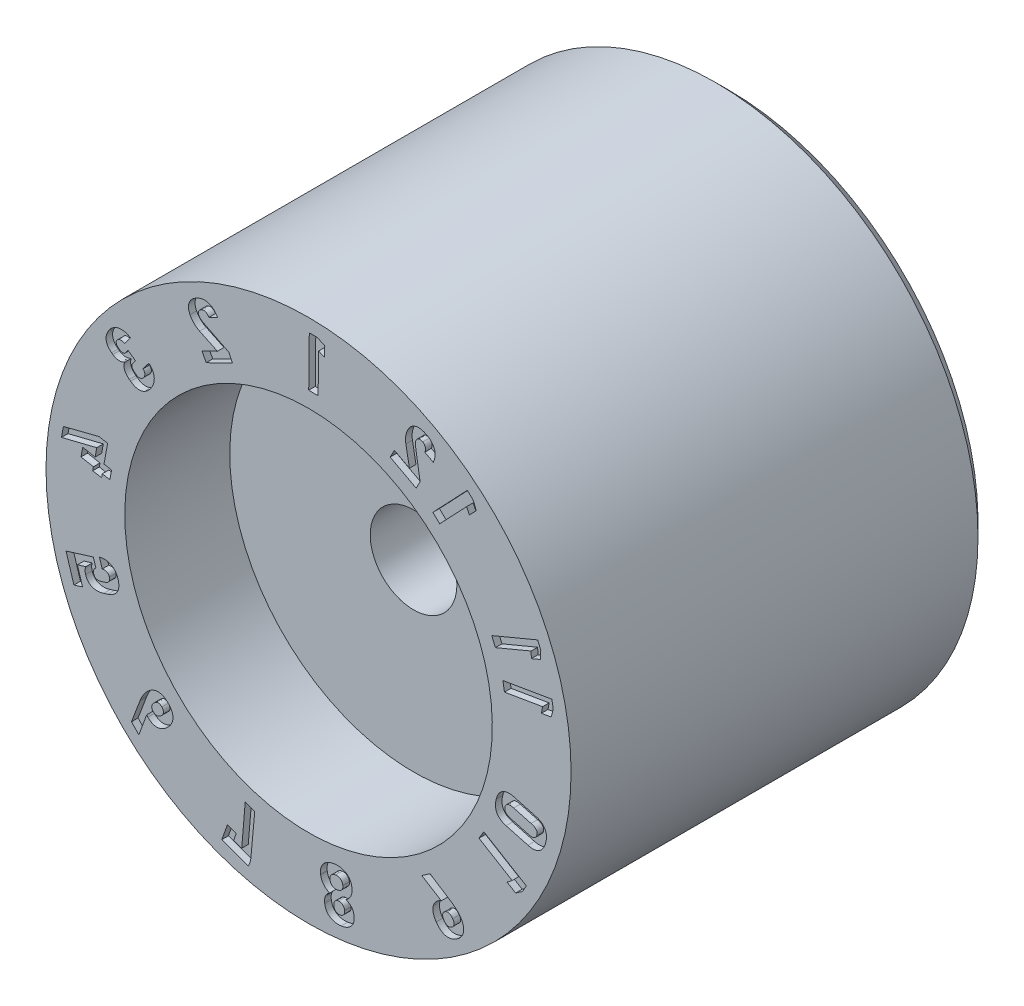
SolidWorks part; units mm, degrees
ref_plane "Front Plane" through (0, 0, 0) normal (0, 0, 1) x (1, 0, 0)
ref_plane "Top Plane" through (0, 0, 0) normal (0, 1, 0) x (1, 0, 0)
ref_plane "Right Plane" through (0, 0, 0) normal (1, 0, 0) x (0, 0, -1)
sketch "Sketch1" plane through (0, 0, 0) normal (-1, 0, 0) x (0, 0, 1)
  line L0 (0, 0) -> (75.4695, 0) construction
  line L2 (-16, -1.65) -> (-16, -9.5)
  line L4 (-15.5, -10) -> (0, -10)
  line L5 (0, -10) -> (0, -7)
  line L7 (0, -7) -> (-4, -7)
  line L8 (-4, -7) -> (-4, -1.65)
  line L9 (-4, -1.65) -> (-16, -1.65)
  line L12 (-16, -9.5) -> (-15.5, -10)
  point P6 (-16, -10)
  dimension "D1" = 16
  dimension "D2" = 20
  dimension "D3" = 14
  dimension "D4" = 4
  dimension "D5" = 3.3
revolve "Revolve1" add sketch "Sketch1" angle 360 about L0
sketch "Sketch2" plane through (0, 0, 0) normal (0, 0, 1) x (0, -1, 0)
  line L0 (-7.5996, 0.0069) -> (-7.5958, 0.3657)
  line L1 (-7.5958, 0.3657) -> (-9.0794, 0.3823)
  line L2 (-9.0794, 0.3823) -> (-8.9886, 0.6135)
  line L3 (-8.9886, 0.6135) -> (-9.3703, 0.6178)
  line L4 (-9.3703, 0.6178) -> (-9.5016, 0.3347)
  line L5 (-9.5016, 0.3347) -> (-9.5049, 0.0284)
  line L6 (-9.5049, 0.0284) -> (-7.5996, 0.0069)
  line L7 (-7.3322, -3.037) -> (-7.8145, -3.9955)
  line L8 (-7.9807, -4.1796) -> (-7.9833, -4.1806)
  line L9 (-8.1027, -3.794) -> (-8.1017, -3.7933)
  line L10 (-8.1017, -3.7933) -> (-8.2622, -3.4647)
  line L11 (-8.2622, -3.4647) -> (-8.2632, -3.4655)
  line L12 (-7.8315, -4.5152) -> (-7.8305, -4.5145)
  line L13 (-7.4689, -4.1482) -> (-7.1449, -3.4711)
  line L14 (-7.1449, -3.4711) -> (-6.8609, -4.0528)
  line L15 (-6.8609, -4.0528) -> (-6.5519, -3.9019)
  line L16 (-6.5519, -3.9019) -> (-7.0432, -2.896)
  line L17 (-7.0432, -2.896) -> (-7.3322, -3.037)
  line L18 (-5.4454, -6.0827) -> (-5.1483, -6.3049)
  line L19 (-4.8363, -6.5796) -> (-4.8629, -6.6151)
  line L20 (-5.1385, -6.6924) -> (-5.2676, -6.5959)
  line L21 (-5.2676, -6.5959) -> (-5.475, -6.8728)
  line L22 (-5.475, -6.8728) -> (-5.3459, -6.9693)
  line L23 (-5.3491, -7.2127) -> (-5.3685, -7.2387)
  line L24 (-5.6349, -7.0057) -> (-5.9309, -6.7844)
  line L25 (-5.0822, -7.4988) -> (-5.0477, -7.4526)
  line L26 (-4.5383, -6.8241) -> (-4.5037, -6.7779)
  line L27 (-2.077, -7.9758) -> (-1.7317, -9.3373)
  line L28 (-1.7317, -9.3373) -> (-1.3338, -9.41)
  line L29 (-1.3338, -9.41) -> (-1.6662, -8.0669)
  line L30 (-1.6662, -8.0669) -> (-1.3258, -8.1293)
  line L31 (-0.8279, -8.2207) -> (-0.7656, -7.882)
  line L32 (-0.7656, -7.882) -> (-0.9119, -7.8552)
  line L33 (-2.0176, -7.6524) -> (-2.077, -7.9758)
  line L34 (-1.4125, -8.602) -> (-1.0607, -8.6665)
  line L35 (-1.0607, -8.6665) -> (-0.974, -8.1939)
  line L36 (-0.859, -7.5674) -> (-1.2109, -7.5029)
  line L37 (-1.2109, -7.5029) -> (-1.2636, -7.7907)
  line L38 (1.8893, -7.964) -> (1.8897, -7.9651)
  line L39 (1.8897, -7.9651) -> (2.2305, -7.8595)
  line L40 (2.2305, -7.8595) -> (2.2301, -7.8583)
  line L41 (2.6162, -7.7531) -> (2.6631, -7.905)
  line L42 (2.3237, -8.0992) -> (2.0053, -8.1979)
  line L43 (2.0053, -8.1979) -> (2.3275, -9.2374)
  line L44 (2.3275, -9.2374) -> (3.299, -8.9366)
  line L45 (3.299, -8.9366) -> (3.1972, -8.6084)
  line L46 (3.1972, -8.6084) -> (2.5665, -8.8036)
  line L47 (2.5665, -8.8036) -> (2.4677, -8.4838)
  line L48 (3.0042, -7.7996) -> (2.9573, -7.6478)
  line L49 (5.4075, -6.137) -> (5.4083, -6.1378)
  line L50 (5.8684, -6.4244) -> (6.7136, -6.744)
  line L51 (6.7136, -6.744) -> (7.0043, -6.4628)
  line L52 (7.0043, -6.4628) -> (6.1949, -6.1653)
  line L54 (6.2113, -5.3707) -> (6.2101, -5.3696)
  line L55 (5.9375, -5.6024) -> (5.9386, -5.6035)
  line L56 (5.6533, -5.8773) -> (5.6525, -5.8765)
  line L57 (9.0204, -2.2051) -> (7.319, -2.0476)
  line L58 (7.319, -2.0476) -> (7.1891, -2.4116)
  line L59 (7.1891, -2.4116) -> (8.7854, -2.5452)
  line L60 (8.7854, -2.5452) -> (8.6761, -2.8512)
  line L61 (8.6761, -2.8512) -> (8.4078, -2.7552)
  line L62 (8.4078, -2.7552) -> (8.288, -3.0911)
  line L63 (8.288, -3.0911) -> (8.8799, -3.3027)
  line L64 (8.8799, -3.3027) -> (9.2435, -2.2847)
  line L65 (9.2435, -2.2847) -> (9.0204, -2.2051)
  line L66 (8.137, 0.4604) -> (8.1679, 0.4643)
  line L67 (8.9852, 0.6117) -> (9.0345, 0.618)
  line L68 (8.8875, 1.7331) -> (8.8382, 1.7268)
  line L69 (8.0105, 1.6566) -> (7.9796, 1.6527)
  line L70 (8.0781, 1.3048) -> (8.096, 1.3074)
  line L71 (8.1585, 0.8236) -> (8.1389, 0.8213)
  line L72 (8.8704, 1.37) -> (8.8887, 1.3727)
  line L73 (8.9408, 0.9662) -> (8.9215, 0.964)
  line L75 (7.5117, 4.861) -> (7.5131, 4.8617)
  line L76 (6.8736, 5.7786) -> (6.8721, 5.7778)
  line L77 (6.5208, 5.373) -> (6.0411, 4.6271)
  line L78 (6.0411, 4.6271) -> (6.2572, 4.3137)
  line L79 (6.2572, 4.3137) -> (6.718, 5.0575)
  line L80 (7.0906, 5.4908) -> (7.0917, 5.4917)
  line L81 (7.3164, 5.1633) -> (7.3153, 5.1624)
  line L82 (3.6319, 6.676) -> (3.9381, 6.4919)
  line L83 (3.9381, 6.4919) -> (4.6987, 7.7561)
  line L84 (4.6987, 7.7561) -> (4.8512, 7.5621)
  line L85 (4.8512, 7.5621) -> (5.0466, 7.8873)
  line L86 (5.0466, 7.8873) -> (4.8703, 8.1423)
  line L87 (4.8703, 8.1423) -> (4.6089, 8.2996)
  line L88 (4.6089, 8.2996) -> (3.6319, 6.676)
  line L89 (3.0089, 7.5227) -> (3.2351, 8.3599)
  line L90 (2.1334, 8.6578) -> (1.9071, 7.8206)
  line L91 (2.2782, 7.8156) -> (2.4566, 8.4754)
  line L92 (2.8644, 8.3648) -> (2.6859, 7.705)
  line L93 (-1.7202, 7.4035) -> (-1.3681, 7.4633)
  line L94 (-1.3681, 7.4633) -> (-1.6145, 8.9162)
  line L95 (-1.6145, 8.9162) -> (-1.3731, 8.8689)
  line L96 (-1.3731, 8.8689) -> (-1.4365, 9.242)
  line L97 (-1.4365, 9.242) -> (-1.7365, 9.321)
  line L98 (-1.7365, 9.321) -> (-2.0368, 9.2698)
  line L99 (-2.0368, 9.2698) -> (-1.7202, 7.4035)
  line L100 (-2.992, 6.9804) -> (-2.6631, 7.1181)
  line L101 (-2.6631, 7.1181) -> (-3.2316, 8.4786)
  line L102 (-3.2316, 8.4786) -> (-2.985, 8.4869)
  line L103 (-2.985, 8.4869) -> (-3.1313, 8.8364)
  line L104 (-3.1313, 8.8364) -> (-3.4415, 8.8452)
  line L105 (-3.4415, 8.8452) -> (-3.7225, 8.7276)
  line L106 (-3.7225, 8.7276) -> (-2.992, 6.9804)
  line L107 (-5.9343, 4.7347) -> (-5.6866, 4.9957)
  line L108 (-5.6866, 4.9957) -> (-6.7643, 6.019)
  line L109 (-6.7643, 6.019) -> (-6.5406, 6.1274)
  line L110 (-6.5406, 6.1274) -> (-6.8178, 6.3903)
  line L111 (-6.8178, 6.3903) -> (-7.1072, 6.2719)
  line L112 (-7.1072, 6.2719) -> (-7.3188, 6.0491)
  line L113 (-7.3188, 6.0491) -> (-5.9343, 4.7347)
  line L114 (-6.7002, 4.2495) -> (-7.761, 4.0777)
  line L115 (-8.0082, 4.1043) -> (-8.0104, 4.1056)
  line L116 (-7.7669, 4.4297) -> (-7.7659, 4.4289)
  line L117 (-7.7659, 4.4289) -> (-7.5934, 4.752)
  line L118 (-7.5934, 4.752) -> (-7.5944, 4.7528)
  line L119 (-8.1926, 3.7861) -> (-8.1913, 3.7856)
  line L120 (-7.6818, 3.7074) -> (-6.9424, 3.8423)
  line L121 (-6.9424, 3.8423) -> (-7.2472, 3.2704)
  line L122 (-7.2472, 3.2704) -> (-6.9433, 3.1086)
  line L123 (-6.9433, 3.1086) -> (-6.4159, 4.0981)
  line L124 (-6.4159, 4.0981) -> (-6.7002, 4.2495)
  line L125 (-1.3258, -8.1293) -> (-1.4125, -8.602)
  line L126 (-0.9119, -7.8552) -> (-0.859, -7.5674)
  line L127 (-0.974, -8.1939) -> (-0.8279, -8.2207)
  line L128 (-1.2636, -7.7907) -> (-2.0176, -7.6524)
  circle A0 centre (0, 0) radius 7.6 construction
  spline S0 degree 3 poles (-7.8145, -3.9955) (-7.8344, -4.0363) (-7.8656, -4.0836) (-7.9117, -4.131) (-7.941, -4.1561) (-7.9645, -4.1715) (-7.9807, -4.1796) knots 0 0 0 0 0.540924 0.666719 0.78521 1 1 1 1
  spline S1 degree 3 poles (-7.9833, -4.1806) (-8.004, -4.191) (-8.037, -4.2009) (-8.0815, -4.1989) (-8.1123, -4.1891) (-8.1409, -4.1718) (-8.1785, -4.1384) (-8.1981, -4.1037) (-8.2106, -4.0797) knots 0 0 0 0 0.246374 0.357484 0.468975 0.586096 0.710177 1 1 1 1
  spline S2 degree 3 poles (-8.2106, -4.0797) (-8.2224, -4.0555) (-8.2345, -4.0166) (-8.2327, -3.9633) (-8.222, -3.9253) (-8.2041, -3.8885) (-8.1673, -3.8404) (-8.1299, -3.8115) (-8.1027, -3.794) knots 0 0 0 0 0.239492 0.352314 0.467332 0.58681 0.712523 1 1 1 1
  spline S3 degree 3 poles (-8.2632, -3.4655) (-8.3115, -3.4931) (-8.3787, -3.5399) (-8.4541, -3.615) (-8.4999, -3.6741) (-8.5367, -3.7364) (-8.5639, -3.8016) (-8.5811, -3.8694) (-8.5886, -3.9395) (-8.5861, -4.0111) (-8.5707, -4.1102) (-8.5426, -4.1818) (-8.5204, -4.2285) knots 0 0 0 0 0.185501 0.271338 0.35402 0.434025 0.511907 0.588797 0.66669 0.746156 0.827115 1 1 1 1
  spline S4 degree 3 poles (-8.5204, -4.2285) (-8.4962, -4.2778) (-8.4556, -4.3473) (-8.3893, -4.4271) (-8.3373, -4.4757) (-8.2822, -4.5147) (-8.2246, -4.5453) (-8.1634, -4.5644) (-8.1001, -4.575) (-8.0345, -4.575) (-7.9426, -4.561) (-7.8751, -4.5369) (-7.8315, -4.5152) knots 0 0 0 0 0.19475 0.283309 0.366633 0.445697 0.521961 0.59653 0.67174 0.748345 0.827521 1 1 1 1
  spline S5 degree 3 poles (-7.8305, -4.5145) (-7.7916, -4.496) (-7.7363, -4.4619) (-7.6677, -4.4081) (-7.6197, -4.3624) (-7.5747, -4.3135) (-7.5219, -4.2434) (-7.4873, -4.1877) (-7.4689, -4.1482) knots 0 0 0 0 0.245976 0.371149 0.498271 0.62543 0.751106 1 1 1 1
  spline S6 degree 3 poles (-4.6368, -6.0217) (-4.6803, -5.9881) (-4.7499, -5.9468) (-4.8475, -5.9057) (-4.9201, -5.8859) (-4.9926, -5.8756) (-5.0643, -5.8752) (-5.135, -5.8848) (-5.2041, -5.904) (-5.2707, -5.9338) (-5.3568, -5.9876) (-5.4119, -6.0426) (-5.4454, -6.0827) knots 0 0 0 0 0.181569 0.26678 0.349602 0.430041 0.508529 0.586128 0.665195 0.745151 0.826793 1 1 1 1
  spline S7 degree 3 poles (-5.1483, -6.3049) (-5.1353, -6.2915) (-5.1145, -6.2736) (-5.0842, -6.2548) (-5.0612, -6.2448) (-5.0381, -6.2378) (-5.0147, -6.2342) (-4.9912, -6.2332) (-4.9676, -6.2356) (-4.9443, -6.2413) (-4.9129, -6.2535) (-4.8908, -6.2667) (-4.8769, -6.2773) knots 0 0 0 0 0.185322 0.271186 0.353768 0.433306 0.511129 0.588304 0.666454 0.745868 0.826198 1 1 1 1
  spline S8 degree 3 poles (-4.8769, -6.2773) (-4.8523, -6.2954) (-4.8201, -6.327) (-4.793, -6.3782) (-4.7832, -6.4174) (-4.7823, -6.4579) (-4.795, -6.5151) (-4.8178, -6.5546) (-4.8363, -6.5796) knots 0 0 0 0 0.264916 0.382863 0.497044 0.612324 0.730419 1 1 1 1
  spline S9 degree 3 poles (-4.8629, -6.6151) (-4.8828, -6.6405) (-4.9132, -6.6766) (-4.9632, -6.7086) (-4.9988, -6.7238) (-5.0351, -6.7293) (-5.0846, -6.726) (-5.1183, -6.7069) (-5.1385, -6.6924) knots 0 0 0 0 0.301108 0.428623 0.546089 0.657263 0.765523 1 1 1 1
  spline S10 degree 3 poles (-5.3459, -6.9693) (-5.3291, -6.9813) (-5.3079, -7.0048) (-5.294, -7.0436) (-5.2911, -7.0747) (-5.2951, -7.1077) (-5.3113, -7.1562) (-5.3321, -7.1906) (-5.3491, -7.2127) knots 0 0 0 0 0.226456 0.333734 0.444659 0.565242 0.694774 1 1 1 1
  spline S11 degree 3 poles (-5.3685, -7.2387) (-5.3844, -7.2594) (-5.4099, -7.2882) (-5.4517, -7.3131) (-5.4823, -7.3239) (-5.5137, -7.3271) (-5.557, -7.3214) (-5.5868, -7.3052) (-5.6047, -7.2917) knots 0 0 0 0 0.287243 0.411792 0.527495 0.639812 0.753407 1 1 1 1
  spline S12 degree 3 poles (-5.6047, -7.2917) (-5.6171, -7.2821) (-5.6344, -7.266) (-5.6514, -7.2398) (-5.6613, -7.2186) (-5.6684, -7.1959) (-5.6726, -7.1718) (-5.6741, -7.1465) (-5.6722, -7.12) (-5.6675, -7.0924) (-5.6563, -7.0536) (-5.6447, -7.0247) (-5.6349, -7.0057) knots 0 0 0 0 0.149751 0.222736 0.297358 0.372558 0.449625 0.529756 0.614461 0.703231 0.795895 1 1 1 1
  spline S13 degree 3 poles (-5.9309, -6.7844) (-5.9596, -6.8314) (-5.9962, -6.9041) (-6.0256, -7.006) (-6.0373, -7.0802) (-6.0397, -7.1533) (-6.0319, -7.2243) (-6.0154, -7.293) (-5.989, -7.3586) (-5.955, -7.4211) (-5.8967, -7.4988) (-5.8432, -7.5496) (-5.8032, -7.5789) knots 0 0 0 0 0.185347 0.27176 0.355595 0.437386 0.516616 0.59533 0.674074 0.753729 0.833597 1 1 1 1
  spline S14 degree 3 poles (-5.8032, -7.5789) (-5.7713, -7.6029) (-5.7223, -7.6348) (-5.6544, -7.6688) (-5.6051, -7.688) (-5.5563, -7.7016) (-5.5079, -7.7103) (-5.4598, -7.7128) (-5.4124, -7.7107) (-5.3659, -7.7031) (-5.3209, -7.6894) (-5.2769, -7.6713) (-5.2349, -7.6472) (-5.1943, -7.6179) (-5.1405, -7.5707) (-5.1049, -7.5286) (-5.0822, -7.4988) knots 0 0 0 0 0.145015 0.212027 0.275759 0.336776 0.395938 0.454132 0.511359 0.568209 0.624973 0.681963 0.740474 0.800697 0.863707 1 1 1 1
  spline S15 degree 3 poles (-5.0477, -7.4526) (-5.0227, -7.4193) (-4.9916, -7.3653) (-4.9692, -7.287) (-4.9614, -7.2282) (-4.9634, -7.1688) (-4.9794, -7.0887) (-5.0051, -7.0319) (-5.0272, -6.9963) knots 0 0 0 0 0.256338 0.378395 0.499234 0.620463 0.74196 1 1 1 1
  spline S16 degree 3 poles (-5.0272, -6.9963) (-5.0067, -7.006) (-4.9745, -7.0168) (-4.9309, -7.0254) (-4.8986, -7.0291) (-4.8664, -7.0284) (-4.8341, -7.0253) (-4.8019, -7.0187) (-4.7589, -7.0057) (-4.7062, -6.981) (-4.6224, -6.9252) (-4.5709, -6.8661) (-4.5383, -6.8241) knots 0 0 0 0 0.120784 0.179432 0.236283 0.292935 0.350396 0.408362 0.467375 0.589077 0.716316 1 1 1 1
  spline S17 degree 3 poles (-4.5037, -6.7779) (-4.4733, -6.736) (-4.4322, -6.6716) (-4.3984, -6.5787) (-4.3839, -6.5114) (-4.3801, -6.4445) (-4.3858, -6.3785) (-4.4029, -6.3137) (-4.4299, -6.2503) (-4.467, -6.1888) (-4.5326, -6.108) (-4.5925, -6.0543) (-4.6368, -6.0217) knots 0 0 0 0 0.178322 0.259914 0.338341 0.414267 0.48915 0.565077 0.643479 0.725106 0.811155 1 1 1 1
  spline S18 degree 3 poles (2.2518, -7.2588) (2.2055, -7.2734) (2.1386, -7.3016) (2.0601, -7.3556) (2.0085, -7.4024) (1.9639, -7.4553) (1.9278, -7.5145) (1.8987, -7.5786) (1.8789, -7.6484) (1.8677, -7.7226) (1.8648, -7.829) (1.8767, -7.9099) (1.8893, -7.964) knots 0 0 0 0 0.164951 0.244387 0.322686 0.400848 0.478265 0.557501 0.639295 0.723925 0.811483 1 1 1 1
  spline S19 degree 3 poles (2.2301, -7.8583) (2.2233, -7.8272) (2.2194, -7.7811) (2.2277, -7.7223) (2.2415, -7.6842) (2.2615, -7.6507) (2.2984, -7.6134) (2.3337, -7.5948) (2.3593, -7.5874) knots 0 0 0 0 0.286251 0.41197 0.532179 0.648041 0.760757 1 1 1 1
  spline S20 degree 3 poles (2.3593, -7.5874) (2.3863, -7.5789) (2.4282, -7.5729) (2.4817, -7.5844) (2.5171, -7.6024) (2.5486, -7.6287) (2.5878, -7.6764) (2.606, -7.7215) (2.6162, -7.7531) knots 0 0 0 0 0.245943 0.357035 0.469046 0.586207 0.710397 1 1 1 1
  spline S21 degree 3 poles (2.6631, -7.905) (2.673, -7.9367) (2.6834, -7.9837) (2.681, -8.0446) (2.6715, -8.0831) (2.6553, -8.117) (2.6225, -8.1548) (2.5886, -8.1727) (2.5643, -8.1799) knots 0 0 0 0 0.302868 0.431901 0.550443 0.661671 0.769584 1 1 1 1
  spline S22 degree 3 poles (2.5643, -8.1799) (2.5415, -8.1867) (2.5064, -8.1934) (2.4601, -8.1898) (2.4276, -8.182) (2.3972, -8.1687) (2.3596, -8.1439) (2.3363, -8.1185) (2.3237, -8.0992) knots 0 0 0 0 0.262338 0.385718 0.507592 0.627408 0.74745 1 1 1 1
  spline S23 degree 3 poles (2.4677, -8.4838) (2.4855, -8.4924) (2.5146, -8.5025) (2.5565, -8.5088) (2.5913, -8.5111) (2.6271, -8.5098) (2.674, -8.5059) (2.7082, -8.4979) (2.7303, -8.4912) knots 0 0 0 0 0.220181 0.34169 0.473688 0.609114 0.742087 1 1 1 1
  spline S24 degree 3 poles (2.7303, -8.4912) (2.774, -8.4774) (2.8367, -8.4509) (2.9077, -8.398) (2.9518, -8.353) (2.9884, -8.3021) (3.0163, -8.245) (3.0355, -8.1824) (3.0463, -8.1144) (3.0483, -8.0417) (3.0407, -7.9349) (3.0207, -7.8541) (3.0042, -7.7996) knots 0 0 0 0 0.163581 0.239383 0.313638 0.387163 0.461531 0.538643 0.619556 0.705725 0.79695 1 1 1 1
  spline S25 degree 3 poles (2.9573, -7.6478) (2.9404, -7.5933) (2.9093, -7.5157) (2.8513, -7.4243) (2.8033, -7.3669) (2.7499, -7.3187) (2.6915, -7.28) (2.6279, -7.2516) (2.5599, -7.2325) (2.4876, -7.2236) (2.3831, -7.2254) (2.3042, -7.2423) (2.2518, -7.2588) knots 0 0 0 0 0.186924 0.272225 0.353505 0.431383 0.507079 0.582002 0.658711 0.737653 0.81986 1 1 1 1
  spline S26 degree 3 poles (5.4078, -5.34) (5.3687, -5.3779) (5.3164, -5.4383) (5.2644, -5.5279) (5.2377, -5.5951) (5.2212, -5.6632) (5.216, -5.7321) (5.2214, -5.8012) (5.2373, -5.8704) (5.2643, -5.9391) (5.316, -6.0325) (5.3681, -6.0967) (5.4075, -6.137) knots 0 0 0 0 0.180435 0.26266 0.341945 0.418745 0.493877 0.569633 0.647322 0.728297 0.813161 1 1 1 1
  spline S27 degree 3 poles (5.4083, -6.1378) (5.4329, -6.1632) (5.473, -6.1995) (5.5308, -6.2446) (5.6283, -6.3123) (5.7169, -6.3599) (5.7907, -6.3927) knots 0 0 0 0 0.229425 0.350331 0.475684 1 1 1 1
  spline S28 degree 3 poles (5.7907, -6.3927) (5.8038, -6.3982) (5.8291, -6.4101) (5.8554, -6.4198) (5.8684, -6.4244) knots 0 0 0 0 0.507579 1 1 1 1
  spline S29 degree 3 poles (6.1949, -6.1653) (6.2144, -6.1526) (6.2325, -6.1378) (6.2492, -6.1217) knots 0.758085 0.758085 0.758085 0.758085 1 1 1 1
  spline S30 degree 3 poles (6.2492, -6.1217) (6.2846, -6.088) (6.3302, -6.0327) (6.375, -5.9509) (6.3965, -5.8887) (6.4089, -5.8252) (6.41, -5.7606) (6.4017, -5.6952) (6.3829, -5.6295) (6.3545, -5.5635) (6.302, -5.4728) (6.2495, -5.4108) (6.2113, -5.3707) knots 0 0 0 0 0.171552 0.250176 0.326702 0.401809 0.476743 0.552956 0.632633 0.716301 0.80484 1 1 1 1
  spline S31 degree 3 poles (6.2101, -5.3696) (6.1711, -5.3281) (6.1078, -5.2741) (6.0156, -5.2183) (5.9469, -5.189) (5.8777, -5.1698) (5.8082, -5.1618) (5.7388, -5.1641) (5.6699, -5.1784) (5.6018, -5.2028) (5.5097, -5.2513) (5.4472, -5.302) (5.4078, -5.34) knots 0 0 0 0 0.18695 0.271963 0.353439 0.431722 0.507098 0.582642 0.658968 0.737738 0.81972 1 1 1 1
  spline S32 degree 3 poles (5.6475, -5.5877) (5.6676, -5.5674) (5.7019, -5.5429) (5.7535, -5.5263) (5.7916, -5.5241) (5.8298, -5.5306) (5.8825, -5.5517) (5.9163, -5.5809) (5.9375, -5.6024) knots 0 0 0 0 0.260089 0.374783 0.488634 0.603178 0.72406 1 1 1 1
  spline S33 degree 3 poles (5.9386, -5.6035) (5.9627, -5.6286) (5.9948, -5.6678) (6.0196, -5.7269) (6.0283, -5.7682) (6.0273, -5.8087) (6.0124, -5.8624) (5.9859, -5.8966) (5.9655, -5.9167) knots 0 0 0 0 0.294173 0.419085 0.536109 0.647083 0.757101 1 1 1 1
  spline S34 degree 3 poles (5.9655, -5.9167) (5.945, -5.9362) (5.91, -5.9612) (5.8558, -5.9735) (5.815, -5.9732) (5.7737, -5.9625) (5.7157, -5.9352) (5.6777, -5.9018) (5.6533, -5.8773) knots 0 0 0 0 0.239607 0.350713 0.462757 0.580918 0.706868 1 1 1 1
  spline S35 degree 3 poles (5.6525, -5.8765) (5.632, -5.8544) (5.6039, -5.8197) (5.5844, -5.7665) (5.579, -5.7283) (5.5832, -5.6906) (5.6009, -5.6399) (5.6272, -5.6072) (5.6475, -5.5877) knots 0 0 0 0 0.27769 0.398449 0.513506 0.626362 0.741961 1 1 1 1
  spline S36 degree 3 poles (7.5356, 0.9874) (7.5427, 0.9312) (7.561, 0.8497) (7.6024, 0.7491) (7.6399, 0.6824) (7.6838, 0.623) (7.7342, 0.5722) (7.7902, 0.5295) (7.8519, 0.4962) (7.9179, 0.4716) (8.0133, 0.4526) (8.0875, 0.4539) (8.137, 0.4604) knots 0 0 0 0 0.18897 0.276572 0.3617 0.443462 0.521959 0.59953 0.67713 0.754933 0.833533 1 1 1 1
  spline S37 degree 3 poles (8.1679, 0.4643) (8.2143, 0.4696) (8.2819, 0.4898) (8.3658, 0.5331) (8.4239, 0.5755) (8.4765, 0.6246) (8.5354, 0.6997) (8.5683, 0.7633) (8.5828, 0.8086) knots 0 0 0 0 0.245874 0.369723 0.497261 0.62485 0.749381 1 1 1 1
  spline S38 degree 3 poles (8.5828, 0.8086) (8.6049, 0.7746) (8.645, 0.7288) (8.7089, 0.6796) (8.7609, 0.6495) (8.8154, 0.6265) (8.8902, 0.6082) (8.9476, 0.6061) (8.9852, 0.6117) knots 0 0 0 0 0.257462 0.383888 0.511837 0.638239 0.759243 1 1 1 1
  spline S39 degree 3 poles (9.0345, 0.618) (9.0812, 0.6237) (9.1488, 0.6414) (9.2311, 0.6818) (9.2855, 0.7199) (9.3334, 0.7655) (9.3746, 0.8174) (9.4078, 0.8761) (9.4339, 0.9402) (9.4522, 1.0095) (9.4648, 1.1103) (9.4621, 1.1883) (9.4548, 1.2409) knots 0 0 0 0 0.16692 0.245622 0.324152 0.401797 0.479414 0.558535 0.640111 0.724597 0.811872 1 1 1 1
  spline S40 degree 3 poles (9.4548, 1.2409) (9.4473, 1.2931) (9.4313, 1.3697) (9.3917, 1.4632) (9.3568, 1.5258) (9.3145, 1.5807) (9.2675, 1.6286) (9.2143, 1.668) (9.1565, 1.6994) (9.0938, 1.7218) (9.0041, 1.7408) (8.934, 1.7391) (8.8875, 1.7331) knots 0 0 0 0 0.18794 0.275344 0.360031 0.441653 0.520786 0.597734 0.675552 0.75395 0.83321 1 1 1 1
  spline S41 degree 3 poles (8.8382, 1.7268) (8.8001, 1.722) (8.7444, 1.7052) (8.6764, 1.6675) (8.6299, 1.6302) (8.5873, 1.5876) (8.5394, 1.522) (8.5129, 1.4669) (8.5011, 1.4278) knots 0 0 0 0 0.242029 0.363319 0.489116 0.616671 0.742842 1 1 1 1
  spline S42 degree 3 poles (8.5011, 1.4278) (8.4739, 1.4671) (8.4272, 1.5226) (8.3493, 1.5789) (8.2862, 1.6141) (8.219, 1.6398) (8.1274, 1.6625) (8.0565, 1.6621) (8.0105, 1.6566) knots 0 0 0 0 0.252401 0.377134 0.504621 0.631739 0.755354 1 1 1 1
  spline S43 degree 3 poles (7.9796, 1.6527) (7.9301, 1.6463) (7.8583, 1.6277) (7.771, 1.5848) (7.7138, 1.5438) (7.6627, 1.4959) (7.6198, 1.4403) (7.5844, 1.3779) (7.5574, 1.3092) (7.5382, 1.235) (7.5241, 1.1272) (7.5287, 1.0437) (7.5356, 0.9874) knots 0 0 0 0 0.166281 0.24502 0.322997 0.400172 0.477621 0.5562 0.638393 0.723135 0.810892 1 1 1 1
  spline S44 degree 3 poles (7.8772, 1.0326) (7.8738, 1.0551) (7.8734, 1.0888) (7.8802, 1.1323) (7.8892, 1.1625) (7.9014, 1.1908) (7.918, 1.2162) (7.9377, 1.2391) (7.9605, 1.2592) (7.9864, 1.276) (8.0246, 1.295) (8.0566, 1.3016) (8.0781, 1.3048) knots 0 0 0 0 0.179137 0.263849 0.346611 0.427375 0.506262 0.584852 0.66468 0.745956 0.827181 1 1 1 1
  spline S45 degree 3 poles (8.096, 1.3074) (8.1161, 1.3107) (8.1462, 1.3101) (8.185, 1.3026) (8.2117, 1.2921) (8.2367, 1.2788) (8.259, 1.2611) (8.2798, 1.2409) (8.2976, 1.2169) (8.3128, 1.19) (8.33, 1.1495) (8.3369, 1.1163) (8.3402, 1.0937) knots 0 0 0 0 0.166691 0.246113 0.323892 0.401265 0.478433 0.557271 0.639209 0.723761 0.811153 1 1 1 1
  spline S46 degree 3 poles (8.3402, 1.0937) (8.3431, 1.071) (8.3447, 1.0372) (8.339, 0.9936) (8.3312, 0.9635) (8.3198, 0.9358) (8.3055, 0.9104) (8.2878, 0.8878) (8.2669, 0.868) (8.2433, 0.8512) (8.2077, 0.8338) (8.1786, 0.826) (8.1585, 0.8236) knots 0 0 0 0 0.18743 0.275451 0.359684 0.44151 0.520155 0.597919 0.676479 0.755124 0.834279 1 1 1 1
  spline S47 degree 3 poles (8.1389, 0.8213) (8.1173, 0.8178) (8.0851, 0.8181) (8.0433, 0.8248) (8.0144, 0.8347) (7.9876, 0.8486) (7.9627, 0.8653) (7.9408, 0.886) (7.9216, 0.9099) (7.9056, 0.937) (7.8873, 0.9771) (7.8802, 1.0102) (7.8772, 1.0326) knots 0 0 0 0 0.172867 0.253862 0.334268 0.413836 0.492611 0.570906 0.651844 0.734729 0.820133 1 1 1 1
  spline S48 degree 3 poles (8.6841, 1.1392) (8.6814, 1.1583) (8.6807, 1.1871) (8.6876, 1.2239) (8.6964, 1.2492) (8.7074, 1.2732) (8.723, 1.2943) (8.7407, 1.314) (8.7622, 1.3304) (8.7856, 1.3452) (8.8215, 1.3604) (8.8502, 1.3679) (8.8704, 1.37) knots 0 0 0 0 0.173858 0.255854 0.335402 0.414135 0.49206 0.570451 0.650798 0.734329 0.818213 1 1 1 1
  spline S49 degree 3 poles (8.8887, 1.3727) (8.9074, 1.3748) (8.9356, 1.3764) (8.9714, 1.3691) (8.9963, 1.3617) (9.0193, 1.3505) (9.0403, 1.3365) (9.059, 1.3193) (9.0756, 1.2996) (9.0895, 1.277) (9.1043, 1.2428) (9.1113, 1.215) (9.1136, 1.1958) knots 0 0 0 0 0.176373 0.2587 0.339762 0.417994 0.495919 0.573464 0.653837 0.735486 0.820065 1 1 1 1
  spline S50 degree 3 poles (9.1136, 1.1958) (9.1163, 1.1767) (9.1169, 1.1481) (9.1114, 1.1112) (9.1036, 1.0857) (9.093, 1.0621) (9.0788, 1.0408) (9.0624, 1.0213) (9.0425, 1.0047) (9.0204, 0.9906) (8.9869, 0.9754) (8.9598, 0.9682) (8.9408, 0.9662) knots 0 0 0 0 0.178886 0.263392 0.345004 0.424567 0.502825 0.581174 0.660014 0.741521 0.823405 1 1 1 1
  spline S51 degree 3 poles (8.9215, 0.964) (8.9018, 0.9611) (8.8726, 0.9606) (8.8347, 0.966) (8.8086, 0.9739) (8.7841, 0.9847) (8.7616, 0.9985) (8.7417, 1.0156) (8.7241, 1.0353) (8.7095, 1.0579) (8.6935, 1.0919) (8.6864, 1.1199) (8.6841, 1.1392) knots 0 0 0 0 0.179228 0.26266 0.34481 0.424891 0.504315 0.582306 0.661155 0.742047 0.824338 1 1 1 1
  spline S52 degree 3 poles (6.718, 5.0575) (6.7186, 5.0557) (6.7231, 5.0415) (6.7387, 5.0011) (6.7601, 4.9655) (6.776, 4.9421) knots 0.562908 0.562908 0.562908 0.562908 0.582426 0.713304 1 1 1 1
  spline S53 degree 3 poles (6.776, 4.9421) (6.802, 4.9046) (6.8468, 4.8532) (6.9191, 4.8008) (6.977, 4.7713) (7.0382, 4.7504) (7.1022, 4.7384) (7.1688, 4.7362) (7.2372, 4.7428) (7.3066, 4.7585) (7.4014, 4.7925) (7.4683, 4.8316) (7.5117, 4.861) knots 0 0 0 0 0.164733 0.243043 0.320867 0.398148 0.47557 0.554854 0.637426 0.722765 0.810744 1 1 1 1
  spline S54 degree 3 poles (7.5131, 4.8617) (7.5606, 4.8942) (7.6254, 4.948) (7.6963, 5.0306) (7.7374, 5.0938) (7.7675, 5.1593) (7.7874, 5.2269) (7.796, 5.2962) (7.7942, 5.3671) (7.7809, 5.4389) (7.7478, 5.5384) (7.7077, 5.6088) (7.6767, 5.6543) knots 0 0 0 0 0.18747 0.273143 0.354214 0.432215 0.507589 0.582962 0.659242 0.737954 0.82021 1 1 1 1
  spline S55 degree 3 poles (7.6767, 5.6543) (7.6463, 5.7001) (7.5934, 5.7605) (7.5129, 5.8271) (7.4497, 5.8638) (7.384, 5.8912) (7.3153, 5.9066) (7.2447, 5.9128) (7.1721, 5.9069) (7.098, 5.8912) (6.9948, 5.8538) (6.9214, 5.8113) (6.8736, 5.7786) knots 0 0 0 0 0.178235 0.259637 0.338302 0.414869 0.490216 0.566018 0.6443 0.726036 0.811611 1 1 1 1
  spline S56 degree 3 poles (6.8721, 5.7778) (6.845, 5.7585) (6.8047, 5.7269) (6.7547, 5.6784) (6.7167, 5.6375) (6.6789, 5.5926) (6.6266, 5.5266) (6.5888, 5.4741) (6.5639, 5.4377) knots 0 0 0 0 0.216736 0.331978 0.452461 0.579604 0.713156 1 1 1 1
  spline S57 degree 3 poles (6.5639, 5.4377) (6.5568, 5.4267) (6.5416, 5.4057) (6.5274, 5.384) (6.5208, 5.373) knots 0 0 0 0 0.504424 1 1 1 1
  spline S58 degree 3 poles (7.0102, 5.195) (6.9941, 5.2183) (6.9751, 5.2566) (6.9703, 5.3115) (6.9765, 5.351) (6.9921, 5.3891) (7.0255, 5.441) (7.0638, 5.4714) (7.0906, 5.4908) knots 0 0 0 0 0.245772 0.358139 0.47098 0.587124 0.711724 1 1 1 1
  spline S59 degree 3 poles (7.0917, 5.4917) (7.118, 5.5102) (7.1594, 5.5319) (7.2175, 5.5452) (7.2578, 5.5447) (7.2958, 5.5355) (7.3443, 5.5105) (7.373, 5.4794) (7.3889, 5.456) knots 0 0 0 0 0.283656 0.407176 0.522865 0.635948 0.74909 1 1 1 1
  spline S60 degree 3 poles (7.3889, 5.456) (7.4055, 5.4323) (7.4244, 5.3938) (7.431, 5.3389) (7.4257, 5.2998) (7.4114, 5.262) (7.3783, 5.2121) (7.3432, 5.1811) (7.3164, 5.1633) knots 0 0 0 0 0.253962 0.366762 0.479369 0.595911 0.717631 1 1 1 1
  spline S61 degree 3 poles (7.3153, 5.1624) (7.2875, 5.1446) (7.2458, 5.1195) (7.1857, 5.1068) (7.1446, 5.1059) (7.1055, 5.1147) (7.0558, 5.1395) (7.0264, 5.1712) (7.0102, 5.195) knots 0 0 0 0 0.286688 0.409654 0.525636 0.638334 0.750719 1 1 1 1
  spline S62 degree 3 poles (2.3165, 7.1487) (2.3588, 7.1368) (2.4219, 7.1246) (2.5049, 7.1173) (2.5625, 7.1184) (2.6174, 7.1239) (2.6692, 7.1361) (2.7184, 7.153) (2.7645, 7.1757) (2.8074, 7.2033) (2.847, 7.2354) (2.8827, 7.2723) (2.9154, 7.3136) (2.9445, 7.3591) (2.9789, 7.428) (2.9987, 7.4837) (3.0089, 7.5227) knots 0 0 0 0 0.147191 0.214626 0.278833 0.339979 0.39887 0.456662 0.513809 0.570752 0.62689 0.68432 0.742478 0.802827 0.865077 1 1 1 1
  spline S63 degree 3 poles (3.2351, 8.3599) (3.2455, 8.3991) (3.2569, 8.4576) (3.2626, 8.535) (3.2604, 8.5894) (3.253, 8.6414) (3.2407, 8.6913) (3.2224, 8.7388) (3.1992, 8.7841) (3.1702, 8.8263) (3.1363, 8.8658) (3.0975, 8.902) (3.0528, 8.9342) (3.0036, 8.964) (2.9285, 8.9998) (2.868, 9.0206) (2.8257, 9.0318) knots 0 0 0 0 0.135734 0.198831 0.259399 0.317671 0.374624 0.430931 0.487646 0.544689 0.602065 0.661305 0.72212 0.786221 0.853656 1 1 1 1
  spline S64 degree 3 poles (2.8257, 9.0318) (2.7834, 9.0433) (2.7205, 9.0565) (2.6375, 9.0634) (2.58, 9.063) (2.5252, 9.0572) (2.4734, 9.0456) (2.424, 9.0297) (2.3781, 9.0072) (2.3353, 8.9799) (2.2956, 8.9482) (2.2596, 8.9114) (2.2274, 8.8697) (2.1985, 8.8235) (2.1633, 8.7539) (2.1443, 8.6971) (2.1334, 8.6578) knots 0 0 0 0 0.146794 0.21411 0.278 0.339037 0.397877 0.455244 0.511944 0.568413 0.624625 0.681541 0.739937 0.80057 0.863571 1 1 1 1
  spline S65 degree 3 poles (1.9071, 7.8206) (1.8967, 7.7814) (1.8854, 7.7229) (1.8796, 7.6456) (1.8819, 7.5911) (1.8892, 7.5391) (1.9015, 7.4892) (1.9198, 7.4417) (1.9432, 7.3965) (1.9717, 7.3539) (2.0056, 7.3144) (2.045, 7.2786) (2.0893, 7.2459) (2.1386, 7.2161) (2.2134, 7.1803) (2.2744, 7.1604) (2.3165, 7.1487) knots 0 0 0 0 0.135706 0.198791 0.259347 0.317607 0.374549 0.430844 0.487547 0.544786 0.602151 0.661264 0.722561 0.786218 0.853639 1 1 1 1
  spline S66 degree 3 poles (2.4068, 7.4833) (2.3905, 7.4882) (2.3666, 7.4958) (2.3388, 7.5122) (2.3205, 7.5254) (2.3046, 7.5406) (2.2912, 7.5576) (2.2797, 7.5762) (2.2685, 7.6042) (2.2587, 7.6435) (2.2572, 7.7179) (2.2665, 7.7759) (2.2782, 7.8156) knots 0 0 0 0 0.126015 0.183326 0.238377 0.292107 0.345479 0.398165 0.45301 0.567973 0.695294 1 1 1 1
  spline S67 degree 3 poles (2.4566, 8.4754) (2.4676, 8.515) (2.4873, 8.5707) (2.5269, 8.6336) (2.5545, 8.6633) (2.5787, 8.6814) (2.5977, 8.6922) (2.6181, 8.6998) (2.6394, 8.7049) (2.6619, 8.7074) (2.6943, 8.7069) (2.7188, 8.7023) (2.7353, 8.6978) knots 0 0 0 0 0.304409 0.431797 0.547028 0.601172 0.654844 0.707489 0.761566 0.816559 0.874111 1 1 1 1
  spline S68 degree 3 poles (2.7353, 8.6978) (2.7515, 8.6928) (2.7754, 8.6853) (2.8034, 8.6688) (2.8218, 8.6556) (2.8378, 8.6404) (2.8509, 8.6232) (2.8627, 8.6048) (2.874, 8.5766) (2.8833, 8.537) (2.8859, 8.4626) (2.8757, 8.4044) (2.8644, 8.3648) knots 0 0 0 0 0.125753 0.182945 0.238822 0.29244 0.344835 0.398224 0.452954 0.568398 0.695928 1 1 1 1
  spline S69 degree 3 poles (2.6859, 7.705) (2.6748, 7.6655) (2.6556, 7.6096) (2.6154, 7.5471) (2.5876, 7.5178) (2.5633, 7.4997) (2.5444, 7.4888) (2.524, 7.4814) (2.5028, 7.4758) (2.4802, 7.4737) (2.4478, 7.474) (2.4232, 7.4788) (2.4068, 7.4833) knots 0 0 0 0 0.304562 0.431163 0.546724 0.600894 0.654593 0.707265 0.76065 0.816466 0.874048 1 1 1 1
  spline S70 degree 3 poles (-7.761, 4.0777) (-7.8058, 4.0706) (-7.8626, 4.067) (-7.9279, 4.0769) (-7.9656, 4.0855) (-7.9919, 4.0961) (-8.0082, 4.1043) knots 0 0 0 0 0.541086 0.665754 0.782975 1 1 1 1
  spline S71 degree 3 poles (-8.0104, 4.1056) (-8.0308, 4.1164) (-8.0585, 4.1372) (-8.083, 4.1745) (-8.0931, 4.2053) (-8.096, 4.2385) (-8.0904, 4.2884) (-8.0753, 4.325) (-8.0624, 4.3489) knots 0 0 0 0 0.245874 0.358404 0.469926 0.586616 0.71008 1 1 1 1
  spline S72 degree 3 poles (-8.0624, 4.3489) (-8.0495, 4.3729) (-8.025, 4.4059) (-7.9805, 4.4356) (-7.9437, 4.4497) (-7.9032, 4.4561) (-7.8426, 4.455) (-7.797, 4.4416) (-7.7669, 4.4297) knots 0 0 0 0 0.241468 0.353132 0.468071 0.586793 0.713263 1 1 1 1
  spline S73 degree 3 poles (-7.5944, 4.7528) (-7.6453, 4.7757) (-7.7228, 4.803) (-7.8283, 4.8203) (-7.9032, 4.8223) (-7.9754, 4.8154) (-8.0443, 4.7993) (-8.1096, 4.7733) (-8.1707, 4.7381) (-8.2272, 4.6941) (-8.2981, 4.6232) (-8.3402, 4.5589) (-8.3646, 4.5132) knots 0 0 0 0 0.185825 0.271799 0.354705 0.434522 0.512615 0.589405 0.667459 0.746593 0.827316 1 1 1 1
  spline S74 degree 3 poles (-8.3646, 4.5132) (-8.3907, 4.4648) (-8.4229, 4.391) (-8.4485, 4.2903) (-8.4578, 4.2196) (-8.4571, 4.1517) (-8.4469, 4.0872) (-8.4279, 4.0259) (-8.3985, 3.9687) (-8.3604, 3.9153) (-8.2951, 3.849) (-8.2357, 3.8088) (-8.1926, 3.7861) knots 0 0 0 0 0.194592 0.282899 0.36658 0.446069 0.522197 0.596817 0.671939 0.748611 0.827686 1 1 1 1
  spline S75 degree 3 poles (-8.1913, 3.7856) (-8.1532, 3.7656) (-8.0935, 3.7395) (-8.0095, 3.7163) (-7.9444, 3.7036) (-7.8781, 3.6962) (-7.7902, 3.6943) (-7.7247, 3.6993) (-7.6818, 3.7074) knots 0 0 0 0 0.246135 0.370379 0.497712 0.625301 0.750899 1 1 1 1
  dimension "D1" = 15.2
extrude "Cut-Extrude1" cut sketch "Sketch2" against normal blind 0.25
